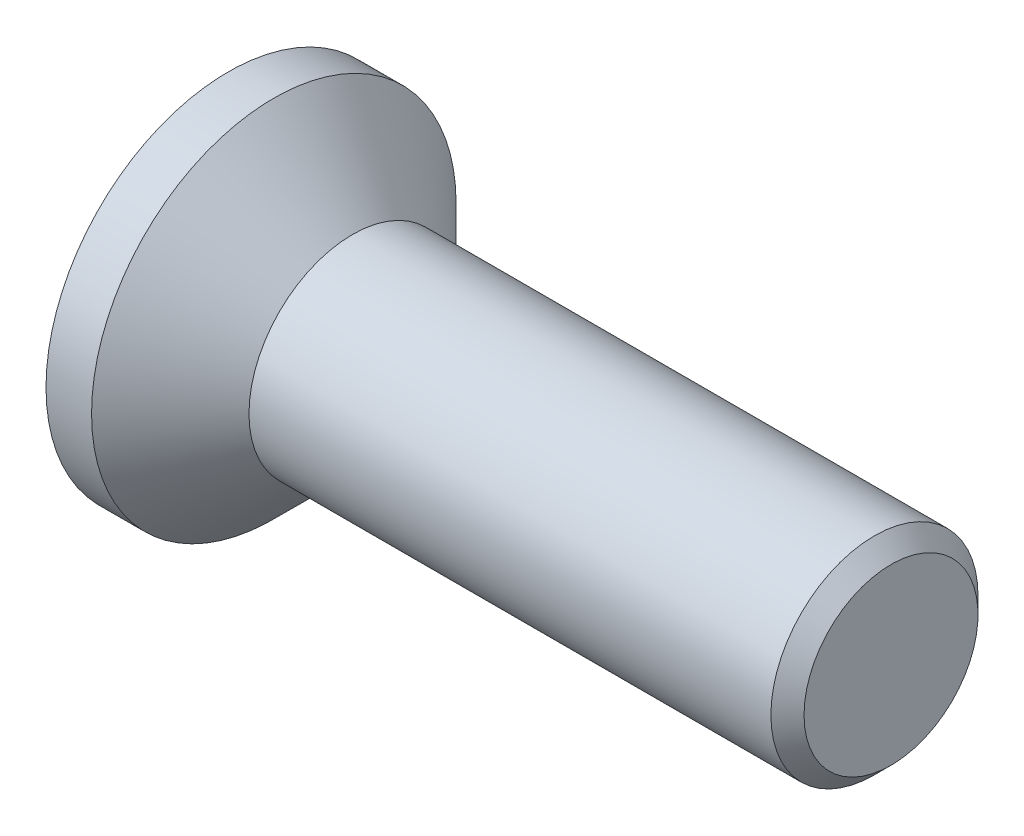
SolidWorks part; units mm, degrees
other "Fillet5"
ref_plane "前视基准面" through (0, 0, 0) normal (0, 0, 1) x (1, 0, 0)
ref_plane "上视基准面" through (0, 0, 0) normal (0, 1, 0) x (1, 0, 0)
ref_plane "右视基准面" through (0, 0, 0) normal (1, 0, 0) x (0, 0, -1)
imported_body "输入1"
sketch "草图1" plane through (4, 0, 0) normal (1, 0, 0) x (0, 0, -1)
  circle A1 centre (0, 0) radius 1.25
  circle A2 centre (0, 0) radius 1.25
  dimension "D1" = 0
extrude "拉伸长度+4=标称长度" add sketch "草图1" along normal blind 4
chamfer "倒角1" distance 0.2 angle 45 1 edges at (8, 0, -1.25)
